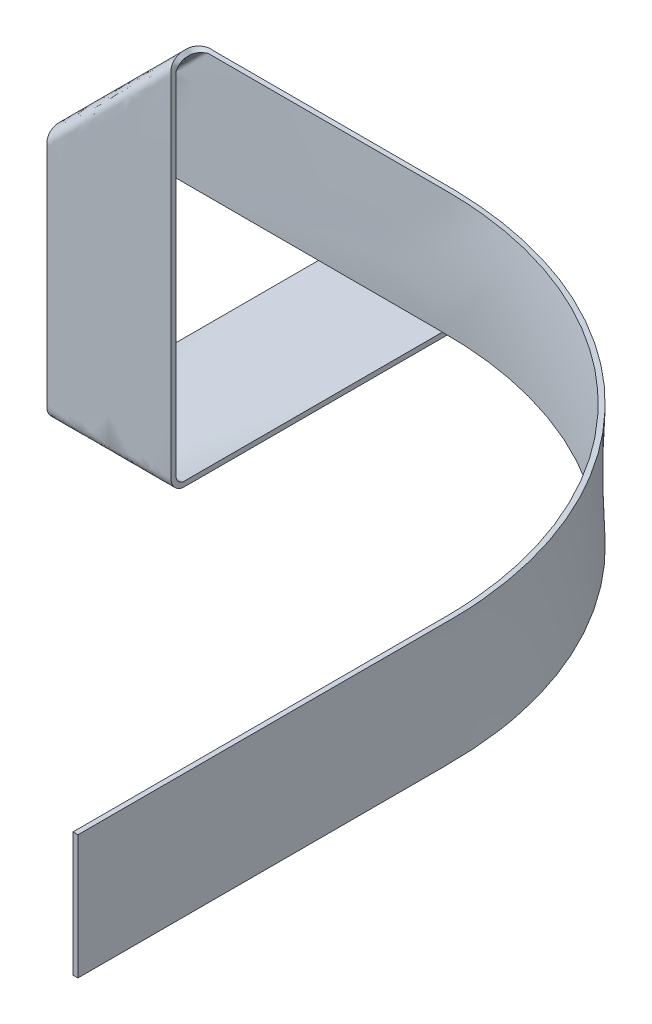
SolidWorks part; units mm, degrees
ref_plane "XY-Vorderansicht" through (0, 0, 0) normal (0, 0, 1) x (1, 0, 0)
ref_plane "XZ-Draufsicht" through (0, 0, 0) normal (0, 1, 0) x (1, 0, 0)
ref_plane "YZ-Seitenansicht" through (0, 0, 0) normal (1, 0, 0) x (0, 0, -1)
sketch3d "3D-Skizze1"
  line L0 (-25, 4.5, 150) -> (-25, 95.5, 150)
  line L1 (-25, 0, 0) -> (25, 0, 0) construction
  line L2 (-25, 0, 0) -> (-25, 0, 145.5)
  line L3 (25, 4.5, 150) -> (25, 145.5, 150)
  line L4 (25, 0, 0) -> (25, 0, 145.5)
  line L5 (-25, 100, 145.5) -> (-25, 100, 144)
  line L6 (25, 150, 145.5) -> (25, 150, 144)
  line L7 (-25, 95.5, 150) -> (25, 145.5, 150) construction
  line L8 (29.5, 150, 139.5) -> (125, 150, 139.5)
  line L9 (-20.5, 100, 139.5) -> (125, 100, 139.5)
  line L10 (275, 150, 139.5) -> (275, 100, 139.5) construction
  line L11 (275, 150, 289.5) -> (275, 150, 439.5)
  line L12 (275, 100, 289.5) -> (275, 100, 439.5)
  line L13 (275, 100, 439.5) -> (275, 150, 439.5) construction
  arc A0 (25, 0, 145.5) -> (25, 4.5, 150) centre (25, 4.5, 145.5) ccw
  arc A1 (-25, 0, 145.5) -> (-25, 4.5, 150) centre (-25, 4.5, 145.5) ccw
  arc A2 (25, 145.5, 150) -> (25, 150, 145.5) centre (25, 145.5, 145.5) ccw
  arc A3 (-25, 95.5, 150) -> (-25, 100, 145.5) centre (-25, 95.5, 145.5) ccw
  arc A4 (-20.5, 100, 139.5) -> (-25, 100, 144) centre (-20.5, 100, 144) ccw
  arc A5 (25, 150, 144) -> (29.5, 150, 139.5) centre (29.5, 150, 144) ccw
  arc A6 (125, 150, 139.5) -> (275, 150, 289.5) centre (125, 150, 289.5) ccw
  arc A7 (125, 100, 139.5) -> (275, 100, 289.5) centre (125, 100, 289.5) ccw
  point P9 (25, 0, 150)
  point P10 (20.5, 4.5, 145.5)
  point P13 (-25, 0, 150)
  point P14 (-29.5, 4.5, 145.5)
  point P19 (25, 150, 150)
  point P20 (20.5, 145.5, 145.5)
  point P23 (-25, 100, 150)
  point P24 (-29.5, 95.5, 145.5)
  point P29 (-25, 100, 139.5)
  point P30 (-20.5, 104.5, 144)
  point P33 (25, 150, 139.5)
  point P34 (29.5, 145.5, 144)
  point P39 (275, 150, 139.5)
  point P41 (125, 0, 289.5)
  point P44 (275, 100, 139.5)
  point P46 (125, -50, 289.5)
  dimension "D2" = 4.5
  dimension "D3" = 4.5
  dimension "D5" = 4.5
  dimension "D7" = 4.5
  dimension "D10" = 150
  dimension "D1" = 50
  dimension "D4" = 150
  dimension "D6" = 45
  dimension "D8" = 10.5
  dimension "D9" = 250
  dimension "D11" = 100
  dimension "D12" = 300
ref_plane "Ebene1" through (25, 0, 0) normal (0, 0, 1) x (1, 0, 0)
sketch "Skizze1" plane through (25, 0, 0) normal (0, 0, 1) x (1, 0, 0)
  line L0 (-50, 0) -> (0, 0)
ref_plane "Ebene2" through (275, 150, 439.5) normal (0, 0, 1) x (1, 0, 0)
sketch "Skizze2" plane through (275, 150, 439.5) normal (0, 0, 1) x (1, 0, 0)
  line L0 (0, 0) -> (0, -50)
ref_plane "Ebene3" through (0, 0, 150) normal (0, 0, -1) x (-1, 0, 0)
sketch "Skizze3" plane through (0, 0, 150) normal (0, 0, -1) x (-1, 0, 0)
  line L0 (25, 95.5) -> (-25, 145.5) construction
  line L1 (25, 95.5) -> (-25, 145.5)
ref_plane "Ebene4" through (0, 0, 139.5) normal (0, 0, 1) x (1, 0, 0)
sketch "Skizze4" plane through (0, 0, 139.5) normal (0, 0, 1) x (1, 0, 0)
  line L0 (-20.5, 100) -> (29.5, 150)
sketch "Skizze5" plane through (0, 0, 150) normal (0, 0, -1) x (-1, 0, 0)
  line L0 (25, 4.5) -> (-25, 4.5)
surface "Oberfläche-Ausformung3"
thicken "Wanddicke auftragen1" thickness 1 thickness side both sides parameters "D1"=1, "Dicke"=5
